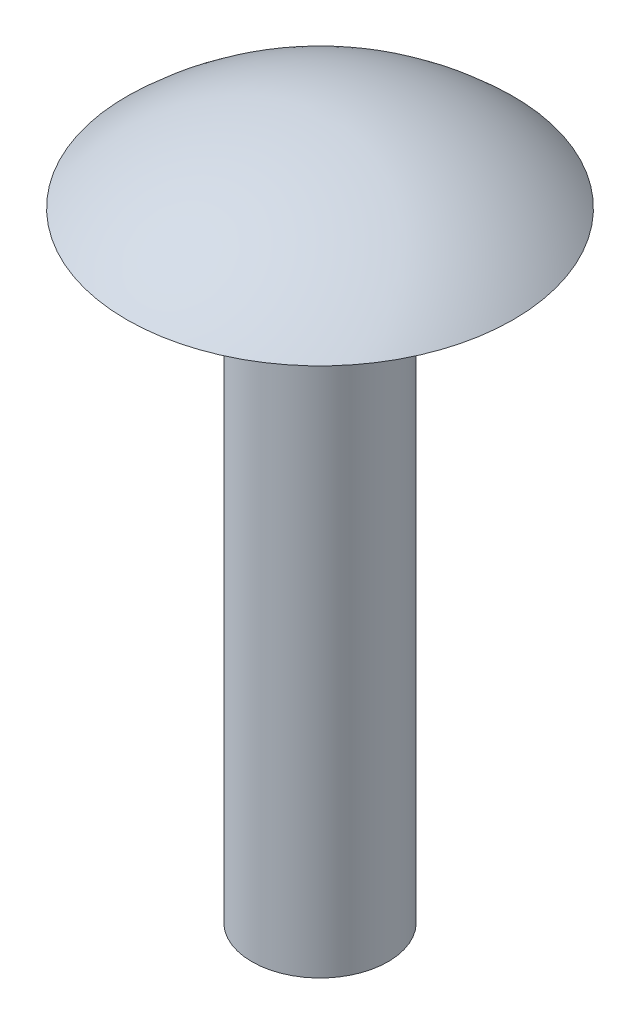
SolidWorks part; units mm, degrees
ref_plane "Front Plane" through (0, 0, 0) normal (0, 0, 1) x (1, 0, 0)
ref_plane "Top Plane" through (0, 0, 0) normal (0, 1, 0) x (1, 0, 0)
ref_plane "Right Plane" through (0, 0, 0) normal (1, 0, 0) x (0, 0, -1)
sketch "Sketch1" plane through (0, 0, 0) normal (0, 0, 1) x (1, 0, 0)
  line L0 (0, 0) -> (0, -12.7) construction
  line L1 (1.397, -12.7) -> (-1.397, -12.7)
  line L2 (-1.397, -12.7) -> (-1.397, 0)
  line L3 (-1.397, 0) -> (-3.9688, 0)
  line L4 (1.397, -12.7) -> (1.397, 0)
  line L5 (1.397, 0) -> (3.9688, 0)
  arc A0 (-3.9688, 0) -> (3.9688, 0) centre (0, -4.1672) cw
  dimension "D1" = 2.794
  dimension "D2" = 12.7
  dimension "D3" = 7.9375
  dimension "D4" = 1.5875
sketch "Sketch2" plane through (0, 0, 0) normal (0, 0, 1) x (1, 0, 0)
  line L0 (1.397, 0) -> (3.9687, 0) construction
  line L1 (1.397, -12.7) -> (1.397, 0) construction
  line L2 (1.397, -12.7) -> (-1.397, -12.7) construction
  line L3 (1.397, 0) -> (3.9687, 0)
  line L4 (1.397, -12.7) -> (1.397, 0)
  line L5 (1.397, -12.7) -> (0, -12.7)
  line L6 (0, 3.532) -> (0, -15.4933) construction
  line L7 (0, -12.7) -> (0, 1.5875)
  arc A0 (3.9687, 0) -> (-3.9687, 0) centre (0, -4.1672) ccw construction
  arc A1 (3.9687, 0) -> (0, 1.5875) centre (0, -4.1672) ccw
revolve "Revolve1" add sketch "Sketch2" angle 360 about L6
